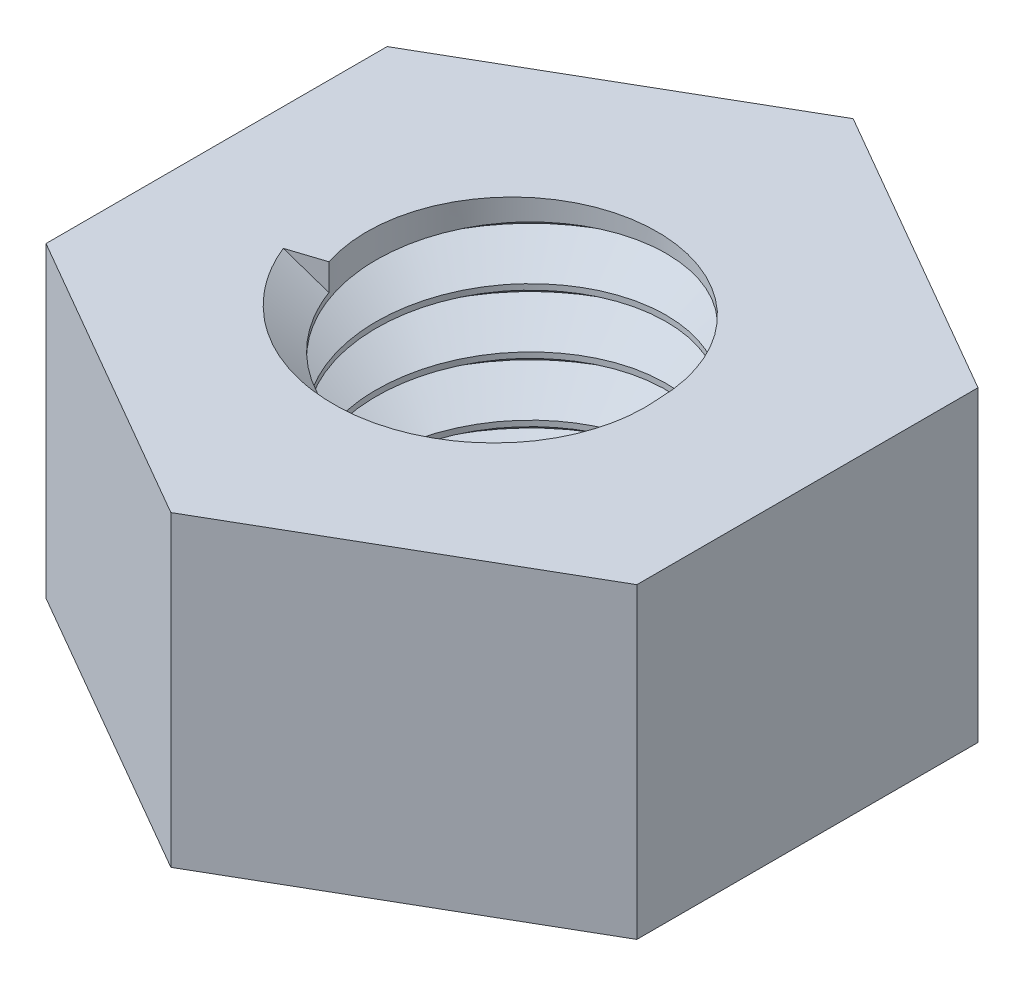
SolidWorks part; units mm, degrees
ref_plane "Alzado" through (0, 0, 0) normal (0, 0, 1) x (1, 0, 0)
ref_plane "Planta" through (0, 0, 0) normal (0, 1, 0) x (1, 0, 0)
ref_plane "Vista lateral" through (0, 0, 0) normal (1, 0, 0) x (0, 0, -1)
sketch "Sk_Hexagono" plane through (0, 0, 0) normal (0, 1, 0) x (1, 0, 0)
  line L0 (5, -2.8868) -> (0, -5.7735)
  line L1 (0, -5.7735) -> (-5, -2.8868)
  line L2 (-5, -2.8868) -> (-5, 2.8868)
  line L3 (-5, 2.8868) -> (0, 5.7735)
  line L4 (0, 5.7735) -> (5, 2.8868)
  line L5 (5, 2.8868) -> (5, -2.8868)
extrude "Hexagono" add sketch "Sk_Hexagono" along normal blind 5.2 from offset 0
sketch3d "Sk_Taladro"
  line L0 (0, -1, 0) -> (0, 6.2, 0)
  dimension "D1" = 7.2
sweep "Taladro" cut path "Sk_Taladro" parameters "D3"=4.9175
sketch "Sk_Helice" plane through (0, 0, 0) normal (0, 1, 0) x (1, 0, 0)
  circle A0 centre (0, 0) radius 2.4587
curve "Helice_rosca"
sketch "Sk_Perfil_rosca" plane through (0, 0, 0) normal (1, 0, 0) x (0, 0, -1)
  line L0 (-2.2587, -0.6) -> (-3.0721, 0)
  line L1 (-3.0721, 0) -> (-2.2587, 0.6)
  line L2 (-2.2587, 0.6) -> (-2.2587, -0.6)
sweep "Rosca_M6x1,0" cut profiles "Sk_Perfil_rosca" path "Helice_rosca"
